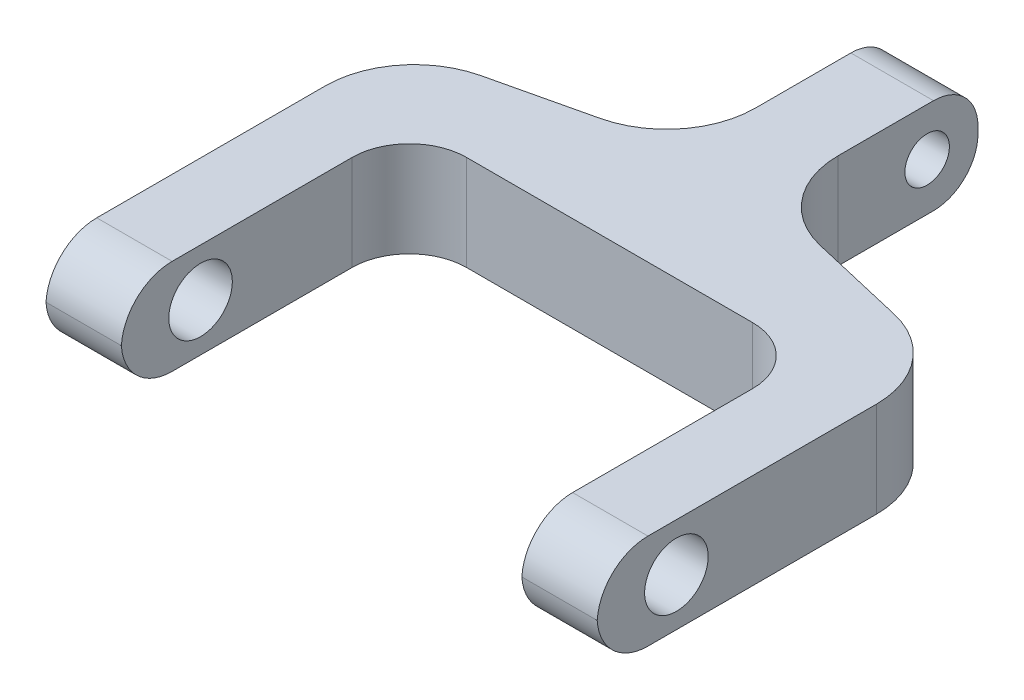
SolidWorks part; units mm, degrees
ref_plane "Front Plane" through (0, 0, 0) normal (0, 0, 1) x (1, 0, 0)
ref_plane "Top Plane" through (0, 0, 0) normal (0, 1, 0) x (1, 0, 0)
ref_plane "Right Plane" through (0, 0, 0) normal (1, 0, 0) x (0, 0, -1)
sketch "Sketch1" plane through (0, 0, 0) normal (0, 1, 0) x (1, 0, 0)
  line L3 (-433.5539, -311.5428) -> (-433.5539, -941.031)
  line L4 (-433.5539, -941.031) -> (-315, -941.031)
  line L5 (-315, -941.031) -> (-315, -387.8718)
  line L6 (-225, -297.8718) -> (225, -297.8718)
  line L7 (315, -387.8718) -> (315, -941.031)
  line L8 (315, -941.031) -> (433.5539, -941.031)
  line L9 (433.5539, -941.031) -> (433.5539, -311.5428)
  line L10 (-65, -3.2971) -> (-65, 276.7029)
  line L11 (-65, 276.7029) -> (65, 276.7029)
  line L12 (65, 276.7029) -> (65, -3.2971)
  line L13 (0, 276.7029) -> (0, -297.8718) construction
  line L14 (-173.1353, -139.6226) -> (-325.4187, -175.2173)
  line L15 (173.1353, -139.6226) -> (325.4187, -175.2173)
  arc A0 (65, -3.2971) -> (173.1353, -139.6226) centre (205, -3.2971) ccw
  arc A1 (-65, -3.2971) -> (-173.1353, -139.6226) centre (-205, -3.2971) cw
  arc A2 (325.4187, -175.2173) -> (433.5539, -311.5428) centre (293.5539, -311.5428) cw
  arc A3 (-325.4187, -175.2173) -> (-433.5539, -311.5428) centre (-293.5539, -311.5428) ccw
  arc A4 (225, -297.8718) -> (315, -387.8718) centre (225, -387.8718) cw
  arc A5 (-315, -387.8718) -> (-225, -297.8718) centre (-225, -387.8718) cw
  point P3 (441.8066, -430.9231)
  point P4 (0, 0)
  point P17 (-65, 0)
  point P18 (-315, -664.4514)
  point P19 (-65, 136.7029)
  point P20 (0, 0)
  point P29 (-470.2522, -812.6253)
  point P32 (315, -297.8718)
  point P35 (-315, -297.8718)
  point P36 (-433.5539, -311.5428)
  point P37 (0, 0)
  dimension "D5" = 140
  dimension "D6" = 140
  dimension "D7" = 90
  dimension "D1" = 130
  dimension "D2" = 630
  dimension "D3" = 801.1543
  dimension "D4" = 140
extrude "Boss-Extrude1" add sketch "Sketch1" along normal blind 150
sketch "Sketch2" plane through (-65, 0, 0) normal (-1, 0, 0) x (0, 0, 1)
  line L0 (-136.7029, 150) -> (-136.7029, 0) construction
  line L1 (-276.7029, 150) -> (3.2971, 150) construction
  line L2 (-276.7029, 0) -> (3.2971, 0) construction
  line L3 (-276.7029, 75) -> (3.2971, 75) construction
  line L4 (-276.7029, 150) -> (-276.7029, 0) construction
  line L5 (3.2971, 150) -> (3.2971, 0) construction
  circle A0 centre (-136.7029, 75) radius 35
  dimension "D1" = 70
extrude "Cut-Extrude1" cut sketch "Sketch2" against normal up to next
sketch "Sketch3" plane through (433.5539, 0, 0) normal (1, 0, 0) x (0, 0, -1)
  line L0 (-626.2869, 0) -> (-626.2869, 150) construction
  line L1 (-941.031, 0) -> (-311.5428, 0) construction
  line L2 (-941.031, 150) -> (-311.5428, 150) construction
  line L3 (-941.031, 75) -> (-311.5428, 75) construction
  line L4 (-941.031, 150) -> (-941.031, 0) construction
  line L5 (-311.5428, 150) -> (-311.5428, 0) construction
  circle A0 centre (-626.2869, 75) radius 50
  dimension "D1" = 100
extrude "Cut-Extrude2" cut sketch "Sketch3" against normal through all
sketch "Sketch4" plane through (0, 0, -276.7029) normal (0, 0, -1) x (-1, 0, 0)
  line L1 (-65, 150) -> (65, 150)
  line L2 (-65, 150) -> (-65, 0)
  line L3 (-65, 0) -> (65, 0)
  line L4 (65, 150) -> (65, 0)
extrude "Cut-Extrude3" cut sketch "Sketch4" against normal blind 60
fillet "Fillet1" radius 70 2 edges at (0, 0, -216.7029) (0, 150, -216.7029)
sketch "Sketch5" plane through (0, 0, 941.031) normal (0, 0, 1) x (1, 0, 0)
  line L1 (315, 150) -> (433.5539, 150)
  line L2 (315, 150) -> (315, 0)
  line L3 (315, 0) -> (433.5539, 0)
  line L4 (433.5539, 150) -> (433.5539, 0)
  line L5 (-433.5539, 150) -> (-315, 150)
  line L6 (-433.5539, 150) -> (-433.5539, 0)
  line L7 (-433.5539, 0) -> (-315, 0)
  line L8 (-315, 150) -> (-315, 0)
extrude "Cut-Extrude4" cut sketch "Sketch5" against normal blind 190
fillet "Fillet2" radius 80 4 edges at (-374.277, 0, 751.031) (-374.277, 150, 751.031) (374.277, 150, 751.031) (374.277, 0, 751.031)
